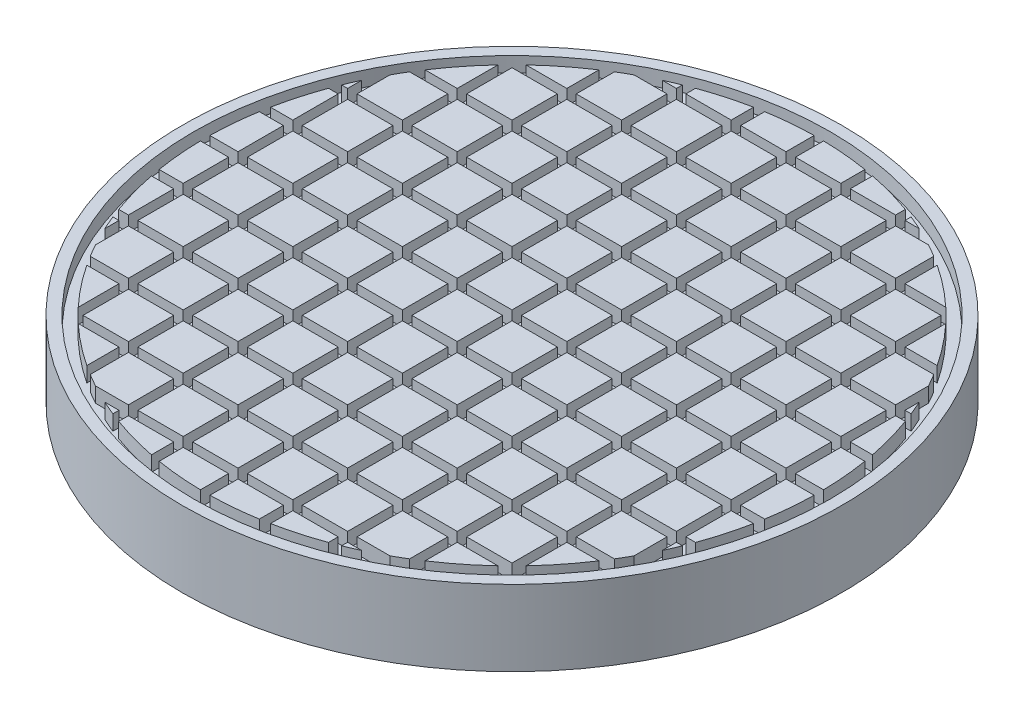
SolidWorks part; units mm, degrees
ref_plane "Front Plane" through (0, 0, 0) normal (0, 0, 1) x (1, 0, 0)
ref_plane "Top Plane" through (0, 0, 0) normal (0, 1, 0) x (1, 0, 0)
ref_plane "Right Plane" through (0, 0, 0) normal (1, 0, 0) x (0, 0, -1)
sketch "Sketch1" plane through (0, 0, 0) normal (0, 1, 0) x (1, 0, 0)
  circle A0 centre (0, 0) radius 87.2
extrude "Boss-Extrude1" add sketch "Sketch1" along normal mid plane 20
sketch "Sketch2" plane through (0, 10, 0) normal (0, 1, 0) x (1, 0, 0)
  line L0 (-142.301, 0) -> (142.301, 0) construction
  line L1 (0, -177.9053) -> (0, 177.9053) construction
  line L2 (-82.7, 0) -> (82.7, 0)
  line L3 (-81.4189, 14.5) -> (81.4189, 14.5)
  line L4 (-77.4486, 29) -> (77.4486, 29)
  line L5 (-70.3352, 43.5) -> (70.3352, 43.5)
  line L6 (-58.9516, 58) -> (58.9516, 58)
  line L8 (-39.7874, 72.5) -> (39.7874, 72.5)
  line L9 (0, 82.7) -> (0, -82.7)
  line L10 (14.5, 81.4189) -> (14.5, -81.4189)
  line L11 (29, 77.4486) -> (29, -77.4486)
  line L12 (43.5, 70.3352) -> (43.5, -70.3352)
  line L14 (58, 58.9516) -> (58, -58.9516)
  line L15 (72.5, 39.7874) -> (72.5, -39.7874)
  line L16 (-14.5, 81.4189) -> (-14.5, -81.4189)
  line L17 (-29, 77.4486) -> (-29, -77.4486)
  line L18 (-43.5, 70.3352) -> (-43.5, -70.3352)
  line L20 (-58, 58.9516) -> (-58, -58.9516)
  line L21 (-72.5, 39.7874) -> (-72.5, -39.7874)
  line L22 (-81.4189, -14.5) -> (81.4189, -14.5)
  line L23 (-77.4486, -29) -> (77.4486, -29)
  line L24 (-70.3352, -43.5) -> (70.3352, -43.5)
  line L26 (-58.9516, -58) -> (58.9516, -58)
  line L27 (-39.7874, -72.5) -> (39.7874, -72.5)
  circle A0 centre (0, 0) radius 82.7
  point P9 (0, 0)
  point P22 (0, 0)
extrude "Cut-Extrude-Thin2" cut sketch "Sketch2" against normal blind 4 thin contours L18 | L20 | L5 | L17 | L8 | L16 | L9 | L10 | L11 | L12 | L14 | L4 | L3 | L15 | L2 | L24 | L23 | L22 | L26 | L27 | L6 | L21
sketch "Sketch5" plane through (0, 10, 0) normal (0, 1, 0) x (1, 0, 0)
  circle A0 centre (0, 0) radius 87.2 construction
  circle A1 centre (0, 0) radius 87.2
  circle A2 centre (0, 0) radius 81.2
  dimension "D1" = 6
extrude "Cut-Extrude-Thin3" cut sketch "Sketch5" against normal blind 4 thin contours A2
equation "\"PlateDiameter\"= 174.4"
equation "\"GrooveOutside\"= 3"
equation "\"GrooveInside\"= 2.5"
equation "\"SquareWidth\" = 12"
equation "\"D1@Sketch1\"=\"PlateDiameter\""
equation "\"D1@Sketch2\"=\"PlateDiameter\"-\"GrooveOutside\"*3"
equation "\"GrooveNumber\" = 6"
equation "\"D2@Sketch2\"=\"GrooveNumber\""
equation "\"D4@Sketch2\"=\"GrooveNumber\""
equation "\"D5@Cut-Extrude-Thin2\"=\"GrooveInside\""
equation "\"D5@Cut-Extrude-Thin3\"=\"GrooveOutside\""
